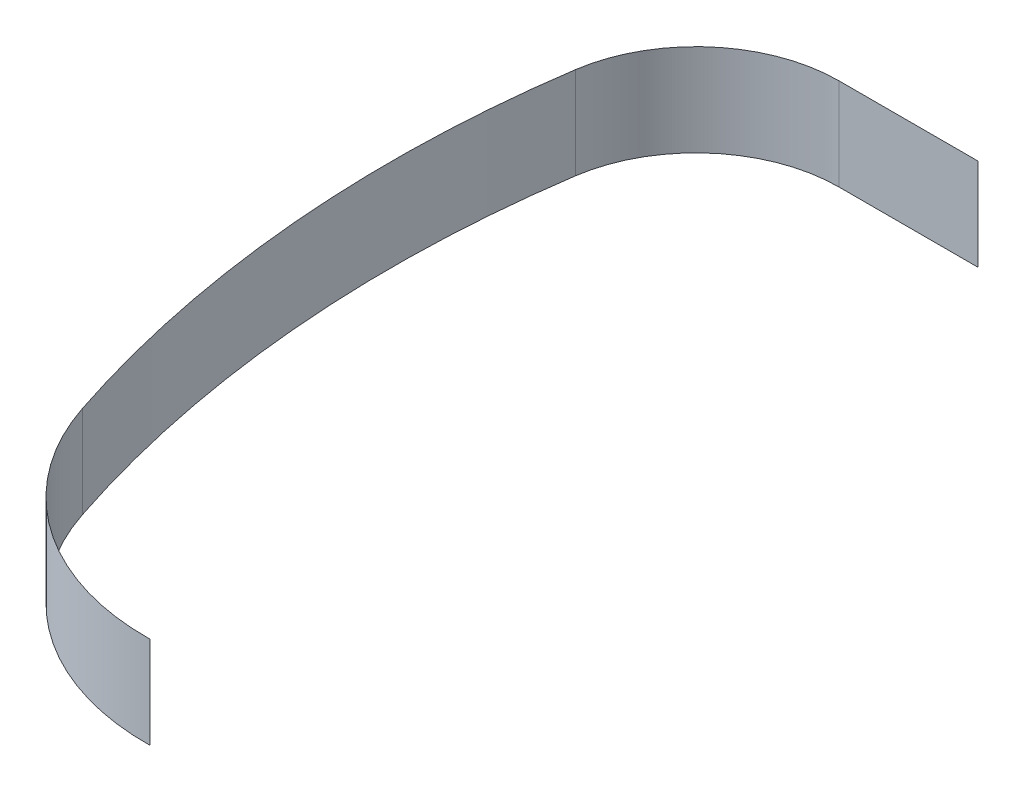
SolidWorks part; units mm, degrees
ref_plane "Front Plane" through (0, 0, 0) normal (0, 0, 1) x (1, 0, 0)
ref_plane "Top Plane" through (0, 0, 0) normal (0, 1, 0) x (1, 0, 0)
ref_plane "Right Plane" through (0, 0, 0) normal (1, 0, 0) x (0, 0, -1)
sketch "Sketch1" plane through (0, 0, 0) normal (0, 1, 0) x (1, 0, 0)
  line L0 (0, 68.5217) -> (-19.182, 68.5217)
  line L1 (0, -45.7783) -> (0, 0) construction
  line L2 (0, 0) -> (0, 68.5217) construction
  line L3 (-38.7154, 51.6641) -> (0, 51.6641) construction
  line L4 (-39.8462, 14.0072) -> (0, 14.0072) construction
  line L5 (-32.2314, -22.8892) -> (0, -22.8892) construction
  arc A0 (-19.182, 68.5217) -> (-38.7154, 51.6641) centre (-19.182, 48.7759) ccw
  arc A1 (-38.7154, 51.6641) -> (-32.2314, -22.8892) centre (121.2242, 28.0157) ccw
  arc A2 (-32.2314, -22.8892) -> (0, -45.7783) centre (-0.5173, -12.3688) ccw
  dimension "D1" = 114.3
surface "Surface-Extrude1" sketch "Sketch1" parameters "D1"=12.7
sketch "Sketch2" plane through (0, 0, 0) normal (1, 0, 0) x (0, 0, -1)
  line L0 (68.5217, 12.7) -> (68.5217, 0) construction
  line L1 (-45.7783, 0) -> (-45.7783, 12.7) construction
  line L2 (23.7486, 34.9047) -> (23.7486, 0) construction
  line L3 (51.6641, 0) -> (-22.8892, 0) construction
  line L4 (-15.2507, 30.6294) -> (-15.2507, 0) construction
  line L5 (-45.7783, 0) -> (68.5217, 0) construction
  arc A0 (-45.7783, 12.7) -> (-44.1579, 15.9055) centre (-41.7975, 12.7) cw
  arc A1 (-44.1579, 15.9055) -> (62.1558, 23.3659) centre (14.8875, -64.2791) cw
  arc A2 (62.1558, 23.3659) -> (68.5217, 12.7) centre (56.4035, 12.7) cw
ref_plane "Plane1" through (0, 25.4, 0) normal (0, 1, 0) x (1, 0, 0)
ref_plane "Plane2" through (-5.4785, 0, -22.4092) normal (-0.2375, 0, -0.9714) x (-0.9714, 0, 0.2375)
ref_plane "Plane3" through (-7.2883, 6.4133, -5.0369) normal (0.6664, -0.5864, 0.4605) x (0.3457, -0.3042, -0.8876)
